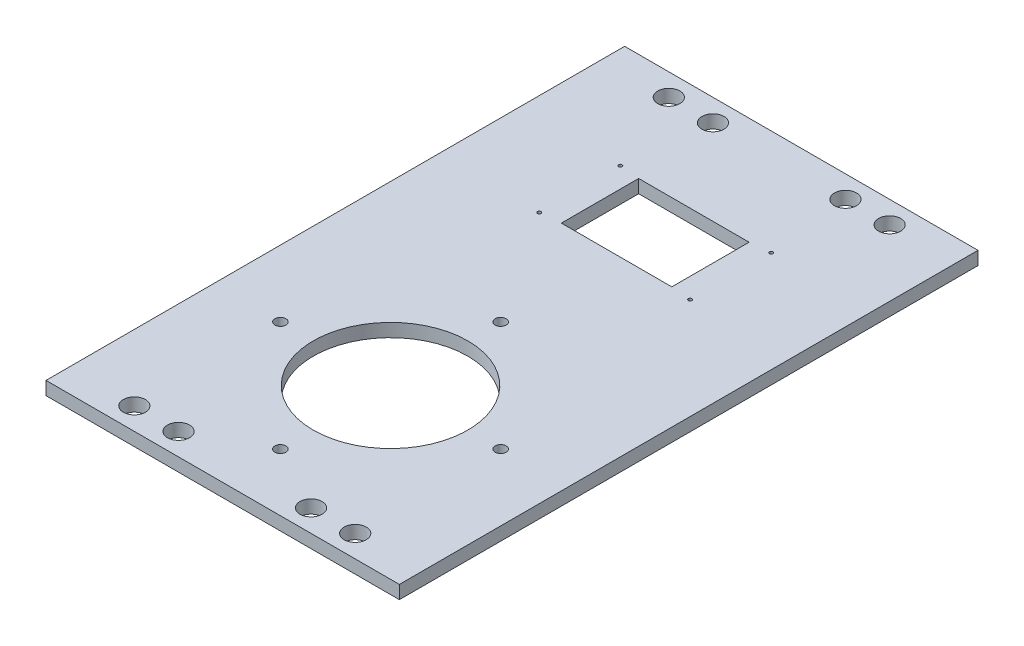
SolidWorks part; units mm, degrees
ref_plane "Front Plane" through (0, 0, 0) normal (0, 0, 1) x (1, 0, 0)
ref_plane "Top Plane" through (0, 0, 0) normal (0, 1, 0) x (1, 0, 0)
ref_plane "Right Plane" through (0, 0, 0) normal (1, 0, 0) x (0, 0, -1)
sketch "Sketch1" plane through (0, 0, 0) normal (0, 1, 0) x (1, 0, 0)
  line L1 (-80, -131) -> (80, -131)
  line L2 (-80, -131) -> (-80, 131)
  line L3 (-80, 131) -> (80, 131)
  line L4 (80, -131) -> (80, 131)
  line L5 (-80, -131) -> (80, 131) construction
  line L6 (-80, 131) -> (80, -131) construction
  point P0 (0, 0)
  dimension "D1" = 262
  dimension "D2" = 160
extrude "Boss-Extrude1" add sketch "Sketch1" along normal blind 6
sketch "Sketch2" plane through (0, 6, 0) normal (0, 1, 0) x (1, 0, 0)
  line L0 (0, -90) -> (0, 90) construction
  line L1 (-30, -90) -> (-30, 90)
  line L2 (30, -90) -> (30, 90)
  arc A0 (-30, -90) -> (30, -90) centre (0, -90) ccw
  arc A1 (30, 90) -> (-30, 90) centre (0, 90) ccw
  point P2 (0, 0)
  dimension "D2" = 30
  dimension "D1" = 180
extrude "Cut-Extrude1" [suppressed] cut sketch "Sketch2" against normal blind 6
sketch "Sketch3" plane through (0, 0, 0) normal (0, -1, 0) x (1, 0, 0)
  circle A0 centre (-50, 121) radius 5
  circle A1 centre (-30, 121) radius 5
  circle A2 centre (30, 121) radius 5
  circle A3 centre (50, 121) radius 5
  dimension "D1" = 10
extrude "Cut-Extrude2" cut sketch "Sketch3" against normal blind 10
mirror "Mirror1" about plane through (0, 0, 0) normal (0, 0, 1) of "Cut-Extrude2"
sketch "Sketch6" plane through (0, 6, 0) normal (0, 1, 0) x (1, 0, 0)
  circle A0 centre (0, -55) radius 35
  dimension "D2" = 70
  dimension "D1" = 55
extrude "Cut-Extrude3" cut sketch "Sketch6" against normal blind 6
sketch "Sketch7" plane through (0, 6, 0) normal (0, 1, 0) x (1, 0, 0)
  circle A0 centre (0, -104.8612) radius 2.5
  circle A1 centre (-49.8612, -55) radius 2.5
  circle A2 centre (49.8612, -55) radius 2.5
  circle A3 centre (0, -5.1388) radius 2.5
  dimension "D1" = 5
extrude "Cut-Extrude4" cut sketch "Sketch7" against normal blind 6
sketch "Sketch8" plane through (0, 6, 0) normal (0, 1, 0) x (1, 0, 0)
  line L1 (34.16, 83.2125) -> (-34.16, 83.2125) construction
  line L2 (34.16, 83.2125) -> (34.16, 46.4925) construction
  line L3 (34.16, 46.4925) -> (-34.16, 46.4925) construction
  line L4 (-34.16, 83.2125) -> (-34.16, 46.4925) construction
  line L5 (34.16, 83.2125) -> (-34.16, 46.4925) construction
  line L6 (34.16, 46.4925) -> (-34.16, 83.2125) construction
  line L7 (25, 47.3525) -> (-25, 47.3525)
  line L8 (25, 47.3525) -> (25, 82.3525)
  line L9 (25, 82.3525) -> (-25, 82.3525)
  line L10 (-25, 47.3525) -> (-25, 82.3525)
  line L11 (25, 47.3525) -> (-25, 82.3525) construction
  line L12 (25, 82.3525) -> (-25, 47.3525) construction
  circle A0 centre (-34.16, 46.4925) radius 0.8
  circle A1 centre (34.16, 46.4925) radius 0.8
  circle A2 centre (-34.16, 83.2125) radius 0.8
  circle A3 centre (34.16, 83.2125) radius 0.8
  arc A4 (7.5, -7.6475) -> (-7.5, -7.6475) centre (0, -7.6475) ccw construction
  point P0 (0, 64.8525)
  point P12 (0, -0.1475)
  point P15 (0, 64.8525)
  dimension "D2" = 1.6
  dimension "D1" = 65
  dimension "D3" = 68.32
  dimension "D4" = 36.72
  dimension "D5" = 50
  dimension "D6" = 35
extrude "Cut-Extrude5" cut sketch "Sketch8" against normal blind 10
